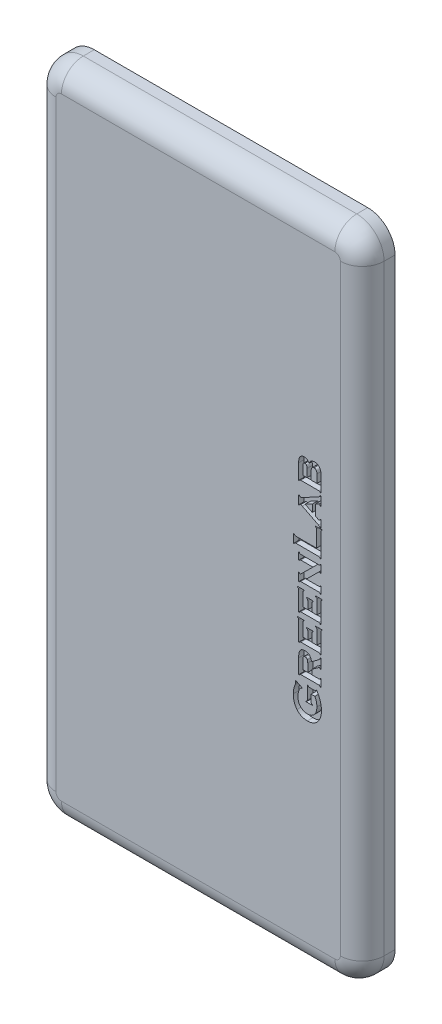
SolidWorks part; units mm, degrees
ref_plane "Front Plane" through (0, 0, 0) normal (0, 0, 1) x (1, 0, 0)
ref_plane "Top Plane" through (0, 0, 0) normal (0, 1, 0) x (1, 0, 0)
ref_plane "Right Plane" through (0, 0, 0) normal (1, 0, 0) x (0, 0, -1)
ref_plane "Plane1" through (0, 0, 3) normal (0, 0, 1) x (1, 0, 0)
sketch "Sketch1" plane through (0, 0, 3) normal (0, 0, 1) x (1, 0, 0)
  line L0 (15, -15) -> (15, 45)
  line L1 (15, 45) -> (-15, 45)
  line L2 (-15, 45) -> (-15, -15)
  line L3 (-15, -15) -> (15, -15)
  dimension "D1" = 30
  dimension "D2" = 60
extrude "Boss-Extrude1" add sketch "Sketch1" against normal blind 3
fillet "Fillet1" radius 2.5 4 edges at (15, 45, 1.5) (15, -15, 1.5) (-15, 45, 1.5) (-15, -15, 1.5)
fillet "Fillet2" radius 2 8 edges at (-15, 15, 3) (-14.2678, 44.2678, 3) (-14.2678, -14.2678, 3) (0, 45, 3) (0, -15, 3) (14.2678, 44.2678, 3) (14.2678, -14.2678, 3) (15, 15, 3)
sketch "Sketch2" plane through (0, 0, 3) normal (0, 0, 1) x (1, 0, 0)
  line L0 (4.9937, -13) -> (4.9937, 43) construction
  line L1 (-12.5, -13) -> (12.5, -13) construction
  line L2 (12.5, 43) -> (-12.5, 43) construction
  line L3 (4.9937, 15) -> (50004.9937, 15) construction
  line L4 (11.2358, 41.0088) -> (11.2358, -11.0088) construction
  text T0 "GreenLab" font "Copperplate Gothic Bold" height 2.5
  point P8 (4.9937, 15)
  point P12 (11.2358, 15)
  dimension "D1" = 6.2421
extrude "Cut-Extrude1" cut sketch "Sketch2" against normal blind 0.5
